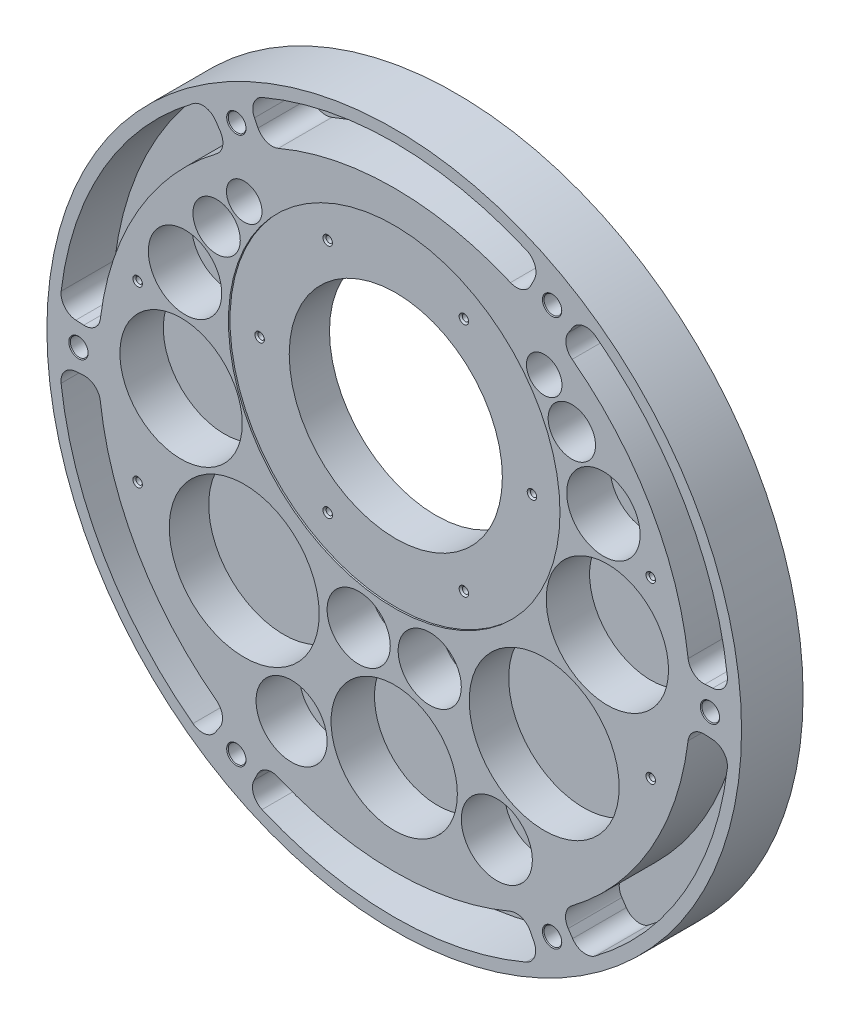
SolidWorks part; units mm, degrees
other "Markup1"
sketch "Sketch20" plane through (279.4, 279.4, 47.625) normal (0.4, 0.515, 0.7581) x (0.8844, 0, -0.4667)
ref_plane "Front" through (0, 0, 0) normal (0, 0, 1) x (1, 0, 0)
ref_plane "Top" through (0, 0, 0) normal (0, 1, 0) x (1, 0, 0)
ref_plane "Right" through (0, 0, 0) normal (1, 0, 0) x (0, 0, -1)
sketch "Sketch1" plane through (0, 0, 0) normal (0, 0, 1) x (1, 0, 0)
  circle A0 centre (0, 0) radius 279.4
  dimension "D1" = 558.8
extrude "Boss-Extrude1 (t=1.875\")" add sketch "Sketch1" along normal blind 49.53
hole_wizard "Mounting Bolt Patter 9/16 (0.5625) Diameter Hole1" positions "Sketch2" profile "Sketch3" hole size "9/16" standard "ANSI Inch"
sketch "Sketch2" plane through (0, 0, 49.53) normal (0, 0, 1) x (1, 0, 0)
  circle A0 centre (0, 0) radius 254
  point P0 (127, 219.9705)
  point P27 (254, 0)
  point P28 (127, -219.9705)
  point P29 (-127, -219.9705)
  point P30 (-254, 0)
  point P31 (-127, 219.9705)
  dimension "D1" = 508
  dimension "D2" = 127
  dimension "D3" = 6
sketch "Sketch3" plane through (127, 219.9705, 49.53) normal (1, 0, 0) x (0, -1, 0)
  line L0 (0, 0) -> (0, 49.53)
  line L1 (0, 49.53) -> (7.7787, 49.53)
  line L2 (7.1437, 48.895) -> (7.1437, 0.635)
  line L3 (7.1437, 0.635) -> (7.7788, 0)
  line L5 (7.7788, 0) -> (0, 0)
  line L6 (-7.1437, 0.635) -> (-7.7788, 0) construction
  line L7 (7.7787, 49.53) -> (7.1437, 48.895)
  line L8 (-7.7788, 49.53) -> (-7.1438, 48.895) construction
  line L11 (0, -6.35) -> (0, 107.95) construction
  dimension "Thru Hole Dia." = 14.2875
  dimension "Thru Hole Depth" = 49.53
  dimension "Near C'Sink Dia." = 15.5575
  dimension "Near C'Sink Angle" = 90
  dimension "Far C'Sink Dia." = 15.5575
  dimension "Far C'Sink Angle" = 90
sketch "Refrence Snoot Placement" plane through (0, 0, 49.53) normal (0, 0, 1) x (1, 0, 0)
  circle A0 centre (0, 78.7908) radius 41.275 construction
  circle A1 centre (0, 120.0658) radius 29.4005 construction
  circle A2 centre (0, 37.5158) radius 29.4005 construction
  circle A3 centre (-41.275, 78.7908) radius 28.575 construction
  circle A4 centre (41.275, 78.7908) radius 28.575 construction
  dimension "D2" = 58.801
  dimension "D3" = 57.15
  dimension "D4" = 82.55
  dimension "D1" = 78.7908
sketch "Sketch5" plane through (0, 0, 49.53) normal (0, 0, 1) x (1, 0, 0)
  circle A0 centre (0, 78.7908) radius 85.725
  dimension "D1" = 171.45
extrude "Light Pass Thru Hole (dia=5.25\")" cut sketch "Sketch5" against normal through all
sketch "Sketch6" plane through (0, 0, 49.53) normal (0, 0, 1) x (1, 0, 0)
  circle A0 centre (0, 78.7908) radius 133.35
  dimension "D1" = 266.7
extrude "Snoot Plate SpotFace (dia=10.50\" - depth=0.050\")" cut sketch "Sketch6" against normal blind 1.27
hole_wizard "1/4-20 Snoot Plate Mounting Tapped Hole" positions "Sketch9" profile "Sketch8" tap size "1/4-20" standard "ANSI Inch"
sketch "Sketch9" plane through (0, 0, 48.26) normal (0, 0, 1) x (1, 0, 0)
  circle A0 centre (0, 78.7908) radius 109.5375 construction
  point P0 (-109.5375, 78.7908)
  point P13 (-54.7687, 173.6531)
  point P14 (54.7688, 173.6531)
  point P15 (109.5375, 78.7908)
  point P16 (54.7687, -16.0715)
  point P17 (-54.7688, -16.0715)
  dimension "D1" = 219.075
  dimension "D2" = 6
sketch "Sketch8" plane through (-109.5375, 78.7908, 48.26) normal (1, 0, 0) x (0, -1, 0)
  line L0 (0, 0) -> (0, 16.51)
  line L1 (0, 16.51) -> (2.5527, 14.9762)
  line L2 (2.5527, 14.9762) -> (2.5527, 1.2573)
  line L3 (2.5527, 1.2573) -> (3.81, 0)
  line L5 (3.81, 0) -> (0, 0)
  line L6 (-2.5527, 1.2573) -> (-3.81, 0) construction
  line L10 (0, 16.51) -> (-2.5527, 14.9762) construction
  line L11 (0, -6.35) -> (0, 107.95) construction
  dimension "Tap Drill Dia." = 5.1054
  dimension "Tap Drill Depth" = 16.51
  dimension "Near C'Sink Dia." = 7.62
  dimension "Near C'Sink Angle" = 90
  dimension "Drill Angle" = 118
sketch "Sketch10" plane through (0, 0, 0) normal (0, 0, -1) x (-1, 0, 0)
  circle A0 centre (0, 0) radius 203.2
  dimension "D1" = 406.4
extrude "Backside Releif (dia=16\" - depth=0.375\")" cut sketch "Sketch10" against normal blind 9.525 contours A0
sketch "Sketch11" plane through (0, 0, 49.53) normal (0, 0, 1) x (1, 0, 0)
  line L0 (109.9361, 225.0985) -> (112.7232, 230.8128)
  line L1 (-109.5567, 225.0985) -> (-112.4127, 230.7838)
  line L2 (0, 238.125) -> (0, 279.4) construction
  line L3 (140.1627, 207.4281) -> (143.6583, 212.7442)
  line L4 (249.9091, 17.3418) -> (256.2514, 17.7853)
  line L5 (249.7193, -17.6704) -> (256.071, -18.0397)
  line L6 (139.973, -207.7567) -> (143.5282, -213.0275)
  line L7 (109.5567, -225.0985) -> (112.4127, -230.7838)
  line L8 (-109.9361, -225.0985) -> (-112.7232, -230.8128)
  line L9 (-140.1627, -207.4281) -> (-143.6583, -212.7442)
  line L10 (-249.9091, -17.3418) -> (-256.2514, -17.7853)
  line L11 (-249.7193, 17.6704) -> (-256.071, 18.0397)
  line L12 (-139.973, 207.7567) -> (-143.5282, 213.0275)
  line L13 (-112.4127, 230.7838) -> (0, 0) construction
  line L14 (0, 0) -> (112.7232, 230.8128) construction
  arc A0 (93.533, 218.9865) -> (-93.2355, 219.1133) centre (0, 0) ccw
  arc A1 (106.3114, 248.0532) -> (-106.0549, 248.163) centre (0, 0) ccw
  circle A2 centre (0, 0) radius 279.4 construction
  arc A3 (93.533, 218.9865) -> (109.9361, 225.0985) centre (98.5214, 230.6658) ccw
  arc A4 (112.7232, 230.8128) -> (106.3114, 248.0532) centre (101.3085, 236.3801) ccw
  arc A5 (-112.4127, 230.7838) -> (-106.0549, 248.163) centre (-101.0641, 236.4847) cw
  arc A6 (-93.2355, 219.1133) -> (-109.5567, 225.0985) centre (-98.2081, 230.7994) cw
  arc A7 (236.4144, 28.4913) -> (143.1399, 190.301) centre (0, 0) ccw
  arc A8 (143.1399, 190.301) -> (140.1627, 207.4281) centre (150.7741, 200.4504) cw
  arc A9 (143.6583, 212.7442) -> (161.888, 215.9278) centre (154.2697, 205.7664) cw
  arc A10 (267.9761, 31.9583) -> (161.888, 215.9278) centre (0, 0) ccw
  arc A11 (256.2514, 17.7853) -> (267.9761, 31.9583) centre (255.3654, 30.4544) ccw
  arc A12 (236.4144, 28.4913) -> (249.9091, 17.3418) centre (249.0231, 30.0109) ccw
  arc A13 (142.8814, -190.4952) -> (236.3755, -28.8123) centre (0, 0) ccw
  arc A14 (236.3755, -28.8123) -> (249.7193, -17.6704) centre (248.9822, -30.349) cw
  arc A15 (256.071, -18.0397) -> (267.9429, -32.2352) centre (255.3338, -30.7183) cw
  arc A16 (161.6647, -216.095) -> (267.9429, -32.2352) centre (0, 0) ccw
  arc A17 (143.5282, -213.0275) -> (161.6647, -216.095) centre (154.057, -205.9258) ccw
  arc A18 (142.8814, -190.4952) -> (139.973, -207.7567) centre (150.5017, -200.6549) ccw
  arc A19 (-93.533, -218.9865) -> (93.2355, -219.1133) centre (0, 0) ccw
  arc A20 (93.2355, -219.1133) -> (109.5567, -225.0985) centre (98.2081, -230.7994) cw
  arc A21 (112.4127, -230.7838) -> (106.0549, -248.163) centre (101.0641, -236.4847) cw
  arc A22 (-106.3114, -248.0532) -> (106.0549, -248.163) centre (0, 0) ccw
  arc A23 (-112.7232, -230.8128) -> (-106.3114, -248.0532) centre (-101.3085, -236.3801) ccw
  arc A24 (-93.533, -218.9865) -> (-109.9361, -225.0985) centre (-98.5214, -230.6658) ccw
  arc A25 (-236.4144, -28.4913) -> (-143.1399, -190.301) centre (0, 0) ccw
  arc A26 (-143.1399, -190.301) -> (-140.1627, -207.4281) centre (-150.7741, -200.4504) cw
  arc A27 (-143.6583, -212.7442) -> (-161.888, -215.9278) centre (-154.2697, -205.7664) cw
  arc A28 (-267.9761, -31.9583) -> (-161.888, -215.9278) centre (0, 0) ccw
  arc A29 (-256.2514, -17.7853) -> (-267.9761, -31.9583) centre (-255.3654, -30.4544) ccw
  arc A30 (-236.4144, -28.4913) -> (-249.9091, -17.3418) centre (-249.0231, -30.0109) ccw
  arc A31 (-142.8814, 190.4952) -> (-236.3755, 28.8123) centre (0, 0) ccw
  arc A32 (-236.3755, 28.8123) -> (-249.7193, 17.6704) centre (-248.9822, 30.349) cw
  arc A33 (-256.071, 18.0397) -> (-267.9429, 32.2352) centre (-255.3338, 30.7183) cw
  arc A34 (-161.6647, 216.095) -> (-267.9429, 32.2352) centre (0, 0) ccw
  arc A35 (-143.5282, 213.0275) -> (-161.6647, 216.095) centre (-154.057, 205.9258) ccw
  arc A36 (-142.8814, 190.4952) -> (-139.973, 207.7567) centre (-150.5017, 200.6549) ccw
  circle A37 centre (0, 0) radius 235.7755 construction
  dimension "D1" = 9.525
  dimension "D5" = 12.7
  dimension "D7" = 471.551
  dimension "1" = 31.75
  dimension "D3" = 52
  dimension "D4" = 26
  dimension "D6" = 6
extrude "Perimeter Pocketing" cut sketch "Sketch11" against normal offset from surface (43.18 mm away) 6.35
sketch "FDL Tube ID (Pressure)" [suppressed] plane through (0, 0, 49.53) normal (0, 0, 1) x (1, 0, 0)
  circle A0 centre (0, -3.7592) radius 203.2 construction
  circle A1 centre (0, 78.7908) radius 82.55 construction
  dimension "D1" = 406.4
sketch "Sketch15" [suppressed] plane through (0, 0, 48.26) normal (0, 0, 1) x (1, 0, 0)
  arc A2 (-77.8309, 187.0709) -> (77.8309, 187.0709) centre (0, 78.7908) ccw
  arc A3 (77.8309, 187.0709) -> (-77.8309, 187.0709) centre (0, 0) ccw
sketch "Sketch33" plane through (0, 0, 49.53) normal (0, 0, 1) x (1, 0, 0)
  line L0 (0, 0) -> (0, 349.6312) construction
  circle A0 centre (-120.65, 168.275) radius 14.2875
  circle A1 centre (120.65, 168.275) radius 14.2875
  circle A2 centre (0, 0) radius 228.0285 construction
  dimension "D1" = 28.575
  dimension "D2" = 168.275
  dimension "D3" = 120.65
  dimension "D4" = 241.3
extrude "Upper 1\" Holes (Depth=1.375\")" cut sketch "Sketch33" against normal blind 34.925
sketch "Sketch21" plane through (0, 0, 49.53) normal (0, 0, 1) x (1, 0, 0)
  line L0 (0, 0) -> (0, 297.1605) construction
  circle A0 centre (-142.875, 139.7) radius 19.05
  circle A1 centre (142.875, 139.7) radius 19.05
  circle A2 centre (0, -6.9342) radius 228.0285 construction
  circle A3 centre (0, 78.7908) radius 85.725 construction
  point P4 (0, 0)
  dimension "D1" = 38.1
  dimension "D2" = 142.875
  dimension "D3" = 285.75
  dimension "D4" = 139.7
extrude "Upper 1.5\" Holes (depth=1.375\")" cut sketch "Sketch21" against normal blind 34.925
sketch "Sketch22" plane through (0, 0, 49.53) normal (0, 0, 1) x (1, 0, 0)
  circle A0 centre (-168.275, 95.25) radius 29.5275
  circle A1 centre (168.275, 95.25) radius 29.5275
  circle A2 centre (0, 0) radius 228.0285 construction
  point P4 (0, 0)
  dimension "D1" = 59.055
  dimension "D2" = 95.25
  dimension "D3" = 336.55
  dimension "D4" = 168.275
extrude "Middle 2.25\" Holes (depth=1.375\")" cut sketch "Sketch22" against normal blind 34.925
sketch "Sketch23" plane through (0, 0, 49.53) normal (0, 0, 1) x (1, 0, 0)
  circle A0 centre (-171.45, 12.7) radius 49.2125
  circle A1 centre (171.45, 12.7) radius 49.2125
  circle A2 centre (0, 0) radius 228.0285 construction
  dimension "D1" = 98.425
  dimension "D4" = 12.7
  dimension "D2" = 171.45
  dimension "D3" = 342.9
extrude "Middle 3.625 Holes (depth=1.375\")" cut sketch "Sketch23" against normal blind 34.925
sketch "Sketch24" plane through (0, 0, 49.53) normal (0, 0, 1) x (1, 0, 0)
  circle A0 centre (-120.65, -88.9) radius 60.325
  circle A1 centre (120.65, -88.9) radius 60.325
  circle A2 centre (0, 0) radius 228.0285 construction
  dimension "D1" = 120.65
  dimension "D2" = 241.3
  dimension "D3" = 120.65
  dimension "D4" = 88.9
extrude "Lower 4.875\" Holes (depth=1.250\")" cut sketch "Sketch24" against normal blind 31.75
sketch "Sketch32" plane through (0, 0, 49.53) normal (0, 0, 1) x (1, 0, 0)
  line L0 (0, 0) -> (0, -284.9279) construction
  circle A0 centre (0, 0) radius 228.0285 construction
  circle A1 centre (-28.575, -82.55) radius 25.4
  circle A2 centre (28.575, -82.55) radius 25.4
  circle A3 centre (0, -158.75) radius 50.8
  circle A4 centre (-82.55, -174.625) radius 28.575
  circle A5 centre (82.55, -174.625) radius 28.575
  dimension "D1" = 50.8
  dimension "D2" = 101.6
  dimension "D9" = 57.15
  dimension "D3" = 57.15
  dimension "D4" = 28.575
  dimension "D5" = 82.55
  dimension "D6" = 158.75
  dimension "D7" = 165.1
  dimension "D8" = 82.55
  dimension "D10" = 174.625
extrude "Bottom 5 Holes (Depth=1.375\")" cut sketch "Sketch32" against normal blind 34.925
sketch "Sketch38" plane through (0, 0, 9.525) normal (0, 0, -1) x (-1, 0, 0)
  circle A0 centre (0, 78.7908) radius 114.3
  dimension "D1" = 228.6
extrude "Back 9\" Releif (Depth=0.250\")" cut sketch "Sketch38" against normal blind 6.35
sketch "Sketch26" plane through (0, 0, 49.53) normal (0, 0, 1) x (1, 0, 0)
  line L0 (0, 0) -> (-0.1617, -238.1249) construction
  arc A1 (-50.9291, -190.1477) -> (50.6709, -190.2167) centre (0, 0) ccw
  arc A2 (-11.1622, -73.1999) -> (11.0628, -73.2071) centre (0, 78.7908) ccw
  arc A3 (-24.6713, -87.6151) -> (-55.7784, -168.1276) centre (-112.7239, -99.8604) cw
  arc A4 (24.561, -87.6418) -> (55.551, -168.2039) centre (112.5952, -100.0191) ccw
  arc A5 (-55.7784, -168.1276) -> (-50.9291, -190.1477) centre (-47.6434, -177.8801) ccw
  arc A6 (55.551, -168.2039) -> (50.6709, -190.2167) centre (47.4018, -177.9446) cw
  arc A7 (24.561, -87.6418) -> (11.0628, -73.2071) centre (11.9847, -85.8736) ccw
  arc A8 (-24.6713, -87.6151) -> (-11.1622, -73.1999) centre (-12.0924, -85.8658) cw
  arc A9 (-93.533, -218.9865) -> (93.2355, -219.1133) centre (0, 0) ccw construction
  dimension "D1" = 393.7
  dimension "D2" = 304.8
  dimension "D3" = 88.9
  dimension "D4" = 12.7
  dimension "D5" = 22.225
  dimension "D6" = 11.1125
  dimension "D7" = 101.6
  dimension "D8" = 50.8
extrude "Cut-Extrude5" [suppressed] cut sketch "Sketch26" against normal blind 25.4
hole_wizard "1/4-20 Tapped Hole1" positions "Sketch29" profile "Sketch30" tap size "1/4-20" standard "ANSI Inch"
sketch "Sketch29" plane through (0, 0, 49.53) normal (0, 0, 1) x (1, 0, 0)
  line L3 (0, 0) -> (0, 346.0877) construction
  line L5 (0, 0) -> (-323.3097, 0) construction
  point P0 (-206.375, 69.977)
  point P2 (-206.375, -69.977)
  point P4 (206.375, -69.977)
  point P6 (206.375, 69.977)
  dimension "D1" = 139.954
  dimension "D2" = 206.375
  dimension "D3" = 69.977
  dimension "D4" = 412.75
sketch "Sketch30" plane through (-206.375, 69.977, 49.53) normal (1, 0, 0) x (0, -1, 0)
  line L0 (0, 0) -> (0, 16.002)
  line L1 (0, 16.002) -> (2.5527, 14.4682)
  line L2 (2.5527, 14.4682) -> (2.5527, 1.2573)
  line L3 (2.5527, 1.2573) -> (3.81, 0)
  line L5 (3.81, 0) -> (0, 0)
  line L6 (-2.5527, 1.2573) -> (-3.81, 0) construction
  line L10 (0, 16.002) -> (-2.5527, 14.4682) construction
  line L11 (0, -6.35) -> (0, 107.95) construction
  dimension "Tap Drill Dia." = 5.1054
  dimension "Tap Drill Depth" = 16.002
  dimension "Near C'Sink Dia." = 7.62
  dimension "Near C'Sink Angle" = 90
  dimension "Drill Angle" = 118
sketch "O-Ring Location" [suppressed] plane through (0, 0, 49.53) normal (0, 0, 1) x (1, 0, 0)
  circle A0 centre (0, 0) radius 231.902 construction
  circle A1 centre (0, 0) radius 228.0285 construction
  dimension "D1" = 463.804
  dimension "D2" = 456.057
sketch "Sketch34" plane through (0, 0, 49.53) normal (0, 0, 1) x (1, 0, 0)
  circle A1 centre (0, 0) radius 203.2
sketch "Sketch35" plane through (0, 0, 48.26) normal (0, 0, 1) x (1, 0, 0)
  arc A0 (-75.6939, 188.5754) -> (75.6939, 188.5754) centre (0, 78.7908) ccw
  arc A1 (75.6939, 188.5754) -> (-75.6939, 188.5754) centre (0, 0) ccw
sketch "Sketch36" [suppressed] plane through (0, 0, 14.605) normal (0, 0, 1) x (1, 0, 0)
  circle A0 centre (0, 0) radius 203.2
ref_plane "Plane1" through (0, 0, 14.605) normal (0, 0, 1) x (1, 0, 0)
sketch "Sketch37" plane through (0, 0, 14.605) normal (0, 0, 1) x (1, 0, 0)
  circle A0 centre (0, 0) radius 203.2
